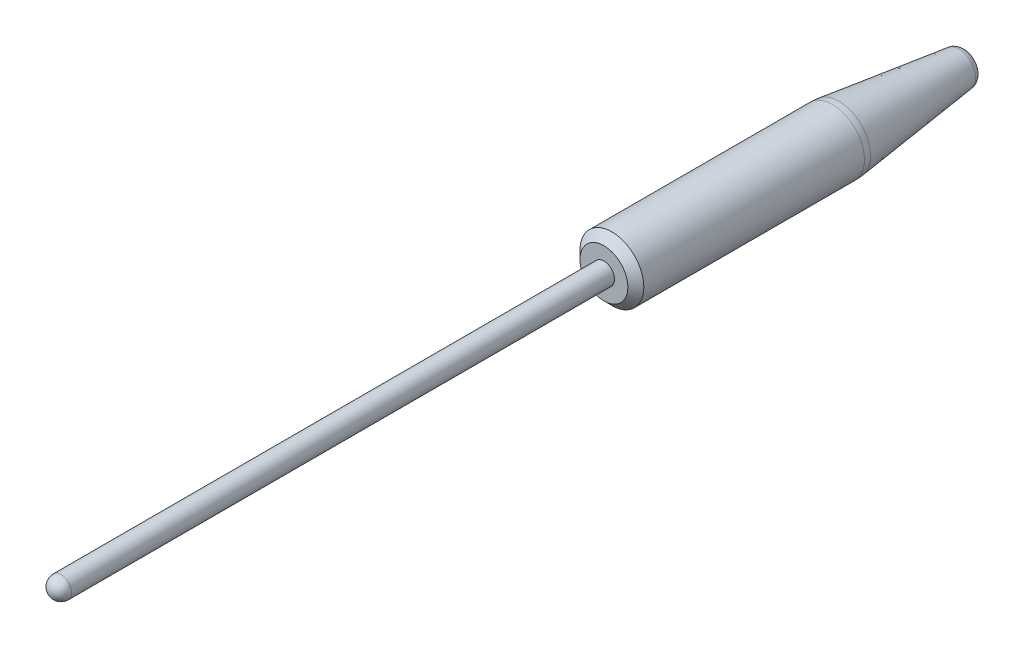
SolidWorks part; units mm, degrees
ref_plane "Plan de face" through (0, 0, 0) normal (0, 0, 1) x (1, 0, 0)
ref_plane "Plan de dessus" through (0, 0, 0) normal (0, 1, 0) x (1, 0, 0)
ref_plane "Plan de droite" through (0, 0, 0) normal (1, 0, 0) x (0, 0, -1)
sketch "Esquisse1" plane through (0, 0, 0) normal (0, 0, 1) x (1, 0, 0)
  circle A0 centre (0, 0) radius 6
extrude "Boss.-Extru.1" add sketch "Esquisse1" along normal blind 68
chamfer "Chanfrein1" distance 3 angle 83 1 edges at (6, 0, 0)
fillet "Congé1" radius 1.5 1 edges at (3, 0, 0)
fillet "Congé2" radius 10 1 edges at (6, 0, 24.433)
chamfer "Chanfrein2" distance 1.5 distance2 1.5 1 edges at (6, 0, 68)
sketch "Esquisse2" plane through (0, 0, 68) normal (0, 0, 1) x (1, 0, 0)
  circle A0 centre (0, 0) radius 2
extrude "Boss.-Extru.2" add sketch "Esquisse2" along normal blind 104
fillet "Congé3" radius 1.99 1 edges at (2, 0, 172)
sketch "Esquisse3" plane through (0, 0, 68) normal (0, 0, 1) x (1, 0, 0)
  text T0 "www.a4.fr" font "Arial Narrow" height 0.01
extrude "Enlèv. mat.-Extru.1" cut sketch "Esquisse3" against normal blind 0.01
